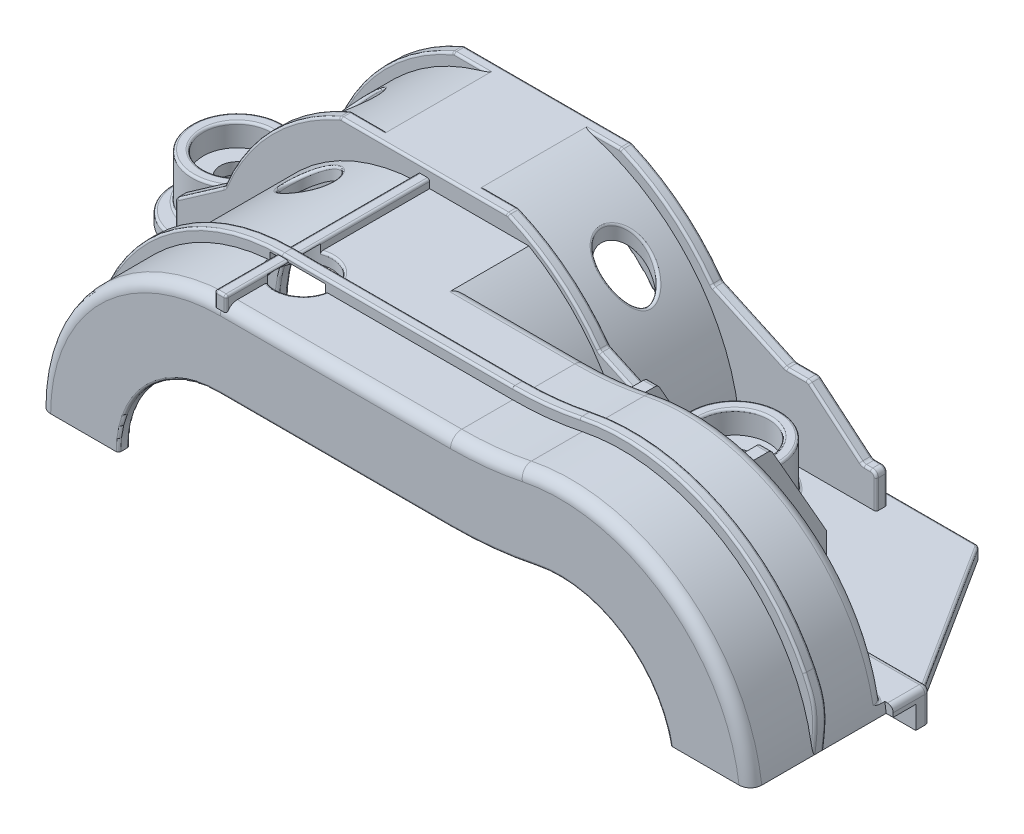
SolidWorks part; units mm, degrees
ref_plane "Face" through (0, 0, 0) normal (0, 0, 1) x (1, 0, 0)
ref_plane "Dessus" through (0, 0, 0) normal (0, 1, 0) x (1, 0, 0)
ref_plane "Droite" through (0, 0, 0) normal (1, 0, 0) x (0, 0, -1)
sketch "Esquisse1" plane through (0, 0, 0) normal (0, 0, 1) x (1, 0, 0)
  line L0 (0, 16) -> (20.3563, 16)
  line L1 (-20.4662, 0) -> (58.8508, 0) construction
  line L2 (0, 15) -> (20.3563, 15)
  line L3 (-15, 0) -> (-16, 0)
  line L4 (46, 0) -> (47, 0)
  arc A0 (0, 16) -> (-16, 0) centre (0, 0) ccw
  arc A1 (20.3563, 16) -> (26.5119, 16.6383) centre (20.3563, 46) ccw
  arc A2 (47, 0) -> (26.5119, 16.6383) centre (30, 0) ccw
  arc A3 (46, 0) -> (26.7171, 15.6596) centre (30, 0) ccw
  arc A4 (20.3563, 15) -> (26.7171, 15.6596) centre (20.3563, 46) ccw
  arc A5 (0, 15) -> (-15, 0) centre (0, 0) ccw
  dimension "D1" = 32
  dimension "D3" = 17
  dimension "D4" = 30
  dimension "D2" = 30
  dimension "D5" = 1
extrude "Extrusion1" add sketch "Esquisse1" against normal blind 10
sketch "Esquisse2" plane through (0, 0, 0) normal (0, 0, 1) x (1, 0, 0)
  line L0 (20.3563, 16) -> (0, 16) construction
  line L1 (20.3563, 16) -> (0, 16)
  line L2 (20.3563, 9) -> (0, 9)
  line L3 (47, 0) -> (40, 0)
  line L4 (-9, 0) -> (-16, 0)
  arc A0 (47, 0) -> (26.5119, 16.6383) centre (30, 0) ccw construction
  arc A1 (20.3563, 16) -> (26.5119, 16.6383) centre (20.3563, 46) ccw construction
  arc A2 (0, 16) -> (-16, 0) centre (0, 0) ccw construction
  arc A3 (47, 0) -> (26.5119, 16.6383) centre (30, 0) ccw
  arc A4 (20.3563, 16) -> (26.5119, 16.6383) centre (20.3563, 46) ccw
  arc A5 (0, 16) -> (-16, 0) centre (0, 0) ccw
  arc A6 (0, 9) -> (-9, 0) centre (0, 0) ccw
  arc A7 (20.3563, 9) -> (27.9482, 9.7872) centre (20.3563, 46) ccw
  arc A8 (40, 0) -> (27.9482, 9.7872) centre (30, 0) ccw
  dimension "D1" = 7
extrude "Extrusion2" add sketch "Esquisse2" along normal blind 1
sketch "Esquisse3" plane through (0, 0, -10) normal (0, 0, -1) x (-1, 0, 0)
  line L1 (-20.3563, 16) -> (0, 16) construction
  line L2 (25.5327, 0) -> (-30.8809, 0) construction
  line L3 (-20.3563, 16) -> (-7.0887, 16)
  line L4 (-17.5, 0) -> (-47, 0)
  arc A0 (16, 0) -> (0, 16) centre (0, 0) ccw construction
  arc A1 (-26.5119, 16.6383) -> (-47, 0) centre (-30, 0) ccw construction
  arc A2 (-7.0887, 16) -> (-17.5, 0) centre (0, 0) ccw
  arc A3 (-26.5119, 16.6383) -> (-20.3563, 16) centre (-20.3563, 46) ccw construction
  arc A4 (-26.5119, 16.6383) -> (-47, 0) centre (-30, 0) ccw
  arc A5 (-26.5119, 16.6383) -> (-20.3563, 16) centre (-20.3563, 46) ccw
  dimension "D1" = 35
extrude "Extrusion3" add sketch "Esquisse3" along normal blind 1
sketch "Esquisse5" plane through (0, 0, -11) normal (0, 0, -1) x (-1, 0, 0)
  line L0 (-7.0887, 16) -> (-20.3563, 16) construction
  line L1 (-7.0887, 16) -> (-9.2871, 16)
  line L2 (-17.5, 0) -> (-18.5, 0)
  line L3 (16, 0) -> (15, 0) construction
  line L4 (-7.0887, 16) -> (0, 16) construction
  line L5 (0, 15) -> (-9.0139, 15) construction
  line L6 (16, 0) -> (15, 0)
  line L7 (-7.0887, 16) -> (0, 16)
  line L8 (0, 15) -> (-9.0139, 15)
  arc A0 (-7.0887, 16) -> (-17.5, 0) centre (0, 0) ccw construction
  arc A1 (-9.0139, 15) -> (-17.5, 0) centre (0, 0) ccw
  arc A2 (-9.2871, 16) -> (-18.5, 0) centre (0, 0) ccw
  arc A3 (15, 0) -> (0, 15) centre (0, 0) ccw construction
  arc A4 (16, 0) -> (0, 16) centre (0, 0) ccw construction
  arc A5 (15, 0) -> (0, 15) centre (0, 0) ccw
  arc A6 (16, 0) -> (0, 16) centre (0, 0) ccw
  dimension "D1" = 1
extrude "Extrusion4" add sketch "Esquisse5" along normal blind 6
sketch "Esquisse6" plane through (0, 0, -10) normal (0, 0, -1) x (-1, 0, 0)
  line L3 (-9.0139, 15) -> (0, 15)
  line L4 (15, 0) -> (16, 0)
  line L5 (0, 16) -> (-7.0887, 16)
  line L6 (-9.0139, 15) -> (0, 15)
  line L7 (15, 0) -> (16, 0)
  line L8 (0, 16) -> (-7.0887, 16)
  arc A3 (-7.0887, 16) -> (-9.0139, 15) centre (0, 0) ccw
  arc A4 (15, 0) -> (0, 15) centre (0, 0) ccw
  arc A5 (16, 0) -> (0, 16) centre (0, 0) ccw
  arc A6 (-7.0887, 16) -> (-9.0139, 15) centre (0, 0) ccw
  arc A7 (15, 0) -> (0, 15) centre (0, 0) ccw
  arc A8 (16, 0) -> (0, 16) centre (0, 0) ccw
  dimension "D1" = 0
extrude "Extrusion5" add sketch "Esquisse6" along normal blind 1
sketch "Esquisse8" plane through (0, 0, -17) normal (0, 0, -1) x (-1, 0, 0)
  line L0 (29.5694, 0) -> (-56.4134, 0) construction
  line L1 (-7.3993, 17.5) -> (7.3993, 17.5)
  line L2 (17.6434, 7.0505) -> (22, 4)
  line L3 (22, 4) -> (22, 0)
  line L4 (22, 0) -> (13, 0)
  line L5 (-15.4919, 11) -> (-22, 8)
  line L6 (-22, 8) -> (-24, 8)
  line L7 (-24, 8) -> (-28.767, 4)
  line L8 (-28.767, 4) -> (-30, 4)
  line L9 (-30, 4) -> (-30, 0)
  line L10 (-30, 0) -> (-13, 0)
  arc A0 (13, 0) -> (-13, 0) centre (0, 0) ccw
  arc A1 (-7.3993, 17.5) -> (-15.4919, 11) centre (0, 0) ccw
  arc A2 (17.6434, 7.0505) -> (7.3993, 17.5) centre (0, 0) ccw
  dimension "D1" = 26
  dimension "D2" = 38
  dimension "D3" = 17.5
  dimension "D4" = 22
  dimension "D5" = 4
  dimension "D6" = 55
  dimension "D7" = 22
  dimension "D8" = 8
  dimension "D9" = 11
  dimension "D10" = 2
  dimension "D11" = 50
  dimension "D12" = 30
  dimension "D13" = 4
extrude "Extrusion6" add sketch "Esquisse8" along normal blind 1
sketch "Esquisse9" plane through (0, 0, -18) normal (0, 0, -1) x (-1, 0, 0)
  line L0 (-4.2131, 17.5) -> (4.2131, 17.5)
  line L1 (7.3993, 17.5) -> (-7.3993, 17.5) construction
  line L2 (-53.6484, 0) -> (31.0271, 0) construction
  line L3 (-4.0927, 16.5) -> (4.0927, 16.5)
  line L4 (-18, 0) -> (-17, 0)
  line L5 (17, 0) -> (18, 0)
  arc A0 (-4.2131, 17.5) -> (-18, 0) centre (0, 0) ccw
  arc A1 (18, 0) -> (4.2131, 17.5) centre (0, 0) ccw
  arc A2 (17, 0) -> (4.0927, 16.5) centre (0, 0) ccw
  arc A3 (-4.0927, 16.5) -> (-17, 0) centre (0, 0) ccw
  dimension "D1" = 36
  dimension "D2" = 1
extrude "Extrusion7" add sketch "Esquisse9" along normal blind 9
sketch "Esquisse10" plane through (0, 0, -27) normal (0, 0, -1) x (-1, 0, 0)
  line L0 (22, 4) -> (17.6434, 7.0505) construction
  line L1 (22, 4) -> (17.6434, 7.0505)
  line L2 (22, 0) -> (22, 4) construction
  line L3 (22, 0) -> (22, 4)
  line L4 (-22, 8) -> (-24, 8) construction
  line L5 (-15.4919, 11) -> (-22, 8) construction
  line L6 (-22, 8) -> (-24, 8)
  line L7 (-15.4919, 11) -> (-22, 8)
  line L8 (-30, 4) -> (-30, 0) construction
  line L9 (-28.767, 4) -> (-30, 4) construction
  line L10 (-24, 8) -> (-28.767, 4) construction
  line L11 (-30, 4) -> (-30, 0)
  line L12 (-28.767, 4) -> (-30, 4)
  line L13 (-24, 8) -> (-28.767, 4)
  line L14 (-7.3993, 17.5) -> (7.3993, 17.5)
  line L15 (22, 0) -> (13, 0)
  line L16 (-13, 0) -> (-30, 0)
  arc A0 (17.6434, 7.0505) -> (7.3993, 17.5) centre (0, 0) ccw construction
  arc A1 (17.6434, 7.0505) -> (7.3993, 17.5) centre (0, 0) ccw
  arc A2 (-7.3993, 17.5) -> (-15.4919, 11) centre (0, 0) ccw construction
  arc A3 (-7.3993, 17.5) -> (-15.4919, 11) centre (0, 0) ccw
  arc A4 (13, 0) -> (-13, 0) centre (0, 0) ccw construction
  arc A5 (13, 0) -> (-13, 0) centre (0, 0) ccw
extrude "Extrusion8" add sketch "Esquisse10" along normal blind 1
sketch "Esquisse11" plane through (0, 0, -18) normal (0, 0, -1) x (-1, 0, 0)
  line L0 (-4.0927, 16.5) -> (4.0927, 16.5) construction
  line L1 (-0.5, 16.5) -> (0.5, 16.5)
  line L2 (0, 0) -> (0, 27.4822) construction
  line L3 (-0.5, 16.5) -> (-0.5, 12.9904)
  line L4 (0.5, 16.5) -> (0.5, 12.9904)
  arc A0 (13, 0) -> (-13, 0) centre (0, 0) ccw construction
  arc A1 (0.5, 12.9904) -> (-0.5, 12.9904) centre (0, 0) ccw
  dimension "D1" = 1
  dimension "D2" = 0.5
extrude "Extrusion9" add sketch "Esquisse11" along normal up to surface (9 mm away)
sketch "Esquisse12" plane through (0, 0, -17) normal (0, 0, 1) x (1, 0, 0)
  line L0 (46, 0) -> (17.5, 0) construction
  line L1 (30, 4) -> (28.7629, 4)
  line L2 (30, 4) -> (30, 0)
  line L3 (30, 0) -> (28.7629, 0)
  line L4 (28.7629, 4) -> (28.7629, 0)
  line L6 (26.691, 0) -> (26.0912, 0)
  line L7 (26.691, 0) -> (26.691, 5.0091)
  line L8 (26.691, 5.0091) -> (26.0912, 5.0091)
  line L9 (26.0912, 0) -> (26.0912, 5.0091)
extrude "Extrusion10" add sketch "Esquisse12" along normal up to surface (6 mm away)
ref_plane "Plan1" through (33, 0, 0) normal (1, 0, 0) x (0, 0, -1)
sketch "Esquisse13" plane through (33, 0, 0) normal (1, 0, 0) x (0, 0, -1)
  line L0 (18.5879, 0) -> (18.5879, 5.7889)
  line L1 (18, 0) -> (11, 0) construction
  line L2 (18.5879, 5.7889) -> (13.6972, 14.3592)
  line L3 (13.6972, 14.3592) -> (11, 14.3592)
  line L4 (11, 14.3592) -> (11, 0)
  line L5 (11, 0) -> (18.5879, 0)
extrude "Extrusion11" add sketch "Esquisse13" along normal blind 1
pattern_linear "Répétition linéaire1" count 2 spacing 10
sketch "Esquisse15" plane through (34, 0, 0) normal (1, 0, 0) x (0, 0, -1)
  line L0 (11, 0) -> (11, 17) construction
  line L1 (11, 0) -> (11, 2.8579)
  line L2 (11, 2.8579) -> (14.3027, 2.8579)
  line L3 (14.3027, 2.8579) -> (14.3027, 0)
  line L4 (11, 0) -> (18.5879, 0) construction
  line L5 (14.3027, 0) -> (11, 0)
extrude "Extrusion12" add sketch "Esquisse15" along normal blind 13.5
sketch "Esquisse16" plane through (0, 0, 0) normal (0, -1, 0) x (1, 0, 0)
  line L0 (46.4203, -14.3027) -> (37.0703, -29)
  line L1 (47.5, -14.3027) -> (34, -14.3027) construction
  line L2 (-22.2, -29) -> (-17, -29)
  line L3 (-17, -27) -> (-17, -18) construction
  line L4 (-17, -29) -> (-17, -17)
  line L5 (-16, -17) -> (-22, -17) construction
  line L6 (-17, -17) -> (-22.2, -17)
  line L7 (-22, -17) -> (-22, -28) construction
  line L8 (17, -27) -> (17, -18) construction
  line L9 (17, -29) -> (17, -17)
  line L10 (17, -29) -> (37.0703, -29)
  line L11 (17.5, -17) -> (17.5, -10) construction
  line L12 (17.5, -17) -> (13, -17) construction
  line L13 (17.5, -17) -> (17.5, -10)
  line L14 (17.5, -17) -> (17, -17)
  line L15 (46.4203, -14.3027) -> (34, -14.3027)
  line L16 (34, -14.3027) -> (34, -10)
  line L17 (17.5, -10) -> (34, -10)
  line L18 (-26.2, -25) -> (-26.2, -21)
  arc A0 (-26.2, -21) -> (-22.2, -17) centre (-22.2, -21) cw
  arc A1 (-22.2, -29) -> (-26.2, -25) centre (-22.2, -25) cw
  dimension "D2" = 4
  dimension "D1" = 4.2
extrude "Extrusion13" add sketch "Esquisse16" against normal blind 1
sketch "Esquisse18" plane through (0, 1, 0) normal (0, 1, 0) x (-1, 0, 0)
  line L0 (22, -27) -> (22, -18) construction
  line L1 (0, 0) -> (0, -64.1616) construction
  circle A0 centre (22, -22.5) radius 4
  circle A1 centre (-22, -22.5) radius 4
  dimension "D1" = 8
extrude "Extrusion14" add sketch "Esquisse18" along normal blind 4
sketch "Esquisse19" plane through (0, 5, 0) normal (0, 1, 0) x (-1, 0, 0)
  circle A0 centre (22, -22.5) radius 3
  circle A1 centre (-22, -22.5) radius 3
  dimension "D1" = 6
  dimension "D2" = 6
extrude "Enlèv. mat.-Extru.1" cut sketch "Esquisse19" against normal blind 2
sketch "Esquisse20" plane through (0, 3, 0) normal (0, 1, 0) x (-1, 0, 0)
  circle A0 centre (-22, -22.5) radius 1.5
  circle A1 centre (22, -22.5) radius 1.5
  dimension "D1" = 3
  dimension "D2" = 3
extrude "Enlèv. mat.-Extru.2" cut sketch "Esquisse20" against normal through all
sketch "Esquisse21" plane through (0, 0, 0) normal (0, -1, 0) x (1, 0, 0)
  circle A0 centre (22, -22.5) radius 3 construction
  circle A1 centre (22, -22.5) radius 3
  circle A2 centre (-22, -22.5) radius 3 construction
  circle A3 centre (-22, -22.5) radius 3
extrude "Enlèv. mat.-Extru.3" cut sketch "Esquisse21" against normal blind 2
sketch "Esquisse22" plane through (0, 0, 0) normal (0, -1, 0) x (1, 0, 0)
  circle A0 centre (-22, -22.5) radius 4 construction
  circle A1 centre (-22, -22.5) radius 3 construction
  circle A2 centre (22, -22.5) radius 4 construction
  circle A3 centre (22, -22.5) radius 3 construction
  circle A4 centre (-22, -22.5) radius 4
  circle A5 centre (-22, -22.5) radius 3
  circle A6 centre (22, -22.5) radius 4
  circle A7 centre (22, -22.5) radius 3
extrude "Extrusion15" add sketch "Esquisse22" along normal blind 1
sketch "Esquisse23" plane through (0, 0, 0) normal (0, -1, 0) x (1, 0, 0)
  line L0 (23.8698, 8.176) -> (52.7064, 8.176)
  line L1 (52.7064, 8.176) -> (52.7064, -11.6178)
  line L2 (52.7064, -11.6178) -> (47.7985, -11.6178)
  line L3 (47.7985, -11.6178) -> (47.7985, -12.9983)
  line L4 (47.7985, -12.9983) -> (42.4143, -12.9983)
  line L5 (42.4143, -12.9983) -> (42.4143, -9.0633)
  line L6 (42.4143, -9.0633) -> (34.5268, -9.0633)
  line L7 (34.5268, -9.0633) -> (34.5268, -13.6379)
  line L8 (34.5268, -13.6379) -> (2.7125, -13.6379)
  line L9 (2.7125, -13.6379) -> (2.7125, 8.176)
  line L10 (2.7125, 8.176) -> (23.8698, 8.176)
extrude "Enlèv. mat.-Extru.4" cut sketch "Esquisse23" against normal blind 2
sketch "Esquisse25" plane through (0, 0, -13.6379) normal (0, 0, 1) x (1, 0, 0)
  line L0 (17.3853, 2) -> (34.5268, 2)
  line L1 (34.5268, 2) -> (34.5268, 0)
  line L2 (34.5268, 0) -> (17.5, 0)
  line L3 (17.5, 0) -> (17.3853, 2)
extrude "Extrusion16" add sketch "Esquisse25" along normal blind 1
sketch "Esquisse28" plane through (33, 0, 0) normal (-1, 0, 0) x (0, 0, 1)
  line L0 (-11, 14.3592) -> (-11, 2) construction
  line L1 (-13.6379, 2) -> (-11, 2)
  line L2 (-13.6379, 2) -> (-13.6379, 2.4171)
  line L3 (-13.6379, 2.4171) -> (-11, 2.4171)
  line L4 (-11, 2) -> (-11, 2.4171)
extrude "Extrusion22" add sketch "Esquisse28" along normal blind 21
sketch "Esquisse29" plane through (0, 0, -11) normal (0, 0, 1) x (1, 0, 0)
  line L0 (12, 2) -> (12, 2.4171) construction
  line L1 (12, 2.4171) -> (17.3323, 2.4171) construction
  line L2 (12, 2) -> (17.3853, 2) construction
  line L3 (12, 2) -> (12, 2.4171)
  line L4 (12, 2.4171) -> (17.3323, 2.4171)
  line L5 (12, 2) -> (17.3853, 2)
  arc A0 (17.3853, 2) -> (9.0139, 15) centre (0, 0) ccw construction
  arc A1 (17.3853, 2) -> (17.3323, 2.4171) centre (0, 0) ccw
extrude "Enlèv. mat.-Extru.5" cut sketch "Esquisse29" against normal blind 2
fillet "Congé3" radius 0.2
fillet "Congé4" radius 1
fillet "Congé5" radius 0.5
fillet "Congé6" radius 0.2
fillet "Congé7" radius 0.2
ref_plane "Plan2" through (0, 0, -5) normal (0, 0, 1) x (1, 0, 0)
sketch "Esquisse30" plane through (0, 0, -5) normal (0, 0, 1) x (1, 0, 0)
  line L0 (0, 16) -> (20.3563, 16) construction
  line L1 (0, 16) -> (20.3563, 16)
  line L2 (0, 17) -> (20.3563, 17)
  line L3 (-16, 0) -> (-17, 0)
  arc A0 (46.8819, 2) -> (26.5119, 16.6383) centre (30, 0) ccw construction
  arc A1 (0, 16) -> (-16, 0) centre (0, 0) ccw construction
  arc A2 (20.3563, 16) -> (26.5119, 16.6383) centre (20.3563, 46) ccw construction
  arc A3 (46.8819, 2) -> (26.5119, 16.6383) centre (30, 0) ccw
  arc A4 (0, 16) -> (-16, 0) centre (0, 0) ccw
  arc A5 (20.3563, 16) -> (26.5119, 16.6383) centre (20.3563, 46) ccw
  arc A6 (46.1515, 7.9454) -> (26.3067, 17.617) centre (30, 0) ccw
  arc A7 (20.3563, 17) -> (26.3067, 17.617) centre (20.3563, 46) ccw
  arc A8 (0, 17) -> (-17, 0) centre (0, 0) ccw
  spline_without_curve S0
  dimension "D1" = 1
extrude "Extrusion23" add sketch "Esquisse30" against normal mid plane 1
sketch "Esquisse31" plane through (0, 0, -17) normal (0, 0, 1) x (1, 0, 0)
  line L0 (0, 0) -> (0, 21.3465) construction
  line L1 (-0.5134, 16.75) -> (-0.5134, 15.4471)
  line L2 (0.5134, 16.75) -> (0.5134, 15.4471)
  line L3 (-0.5134, 15.4471) -> (0.5134, 15.4471)
  line L4 (-0.5134, 16.75) -> (0.5134, 16.75)
  line L5 (0, 16) -> (9.2871, 16) construction
  point P8 (0, 15.4471)
  point P9 (0, 16.75)
  dimension "D1" = 0.75
extrude "Extrusion24" add sketch "Esquisse31" along normal up to surface (18 mm away)
fillet "Congé8" radius 0.2
fillet "Congé9" radius 0.2
fillet "Congé10" radius 0.2
sketch "Esquisse32" plane through (0, 0, 0) normal (0, -1, 0) x (1, 0, 0)
  line L0 (0, 0) -> (0, -39.8244) construction
  line L1 (13, -27.2) -> (0.2955, -27.2) construction
  circle A0 centre (12, -22.7) radius 2
  circle A1 centre (-12, -22.7) radius 2
  circle A2 centre (-7.1964, -14.1439) radius 2
  circle A3 centre (1.3604, -4.9995) radius 2.5
  dimension "D2" = 4
  dimension "D4" = 4
  dimension "D5" = 5
  dimension "D1" = 4.5
  dimension "D3" = 12
extrude "Enlèv. mat.-Extru.6" cut sketch "Esquisse32" against normal blind 16.6
fillet "Congé11" radius 0.2
fillet "Congé12" radius 0.2
